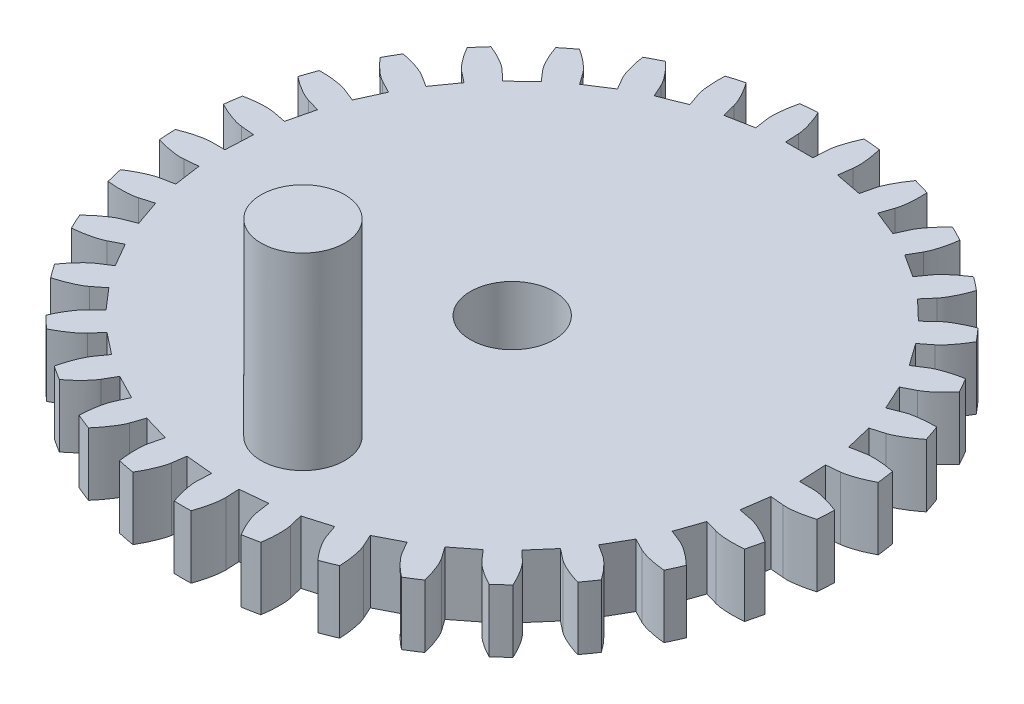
SolidWorks part; units mm, degrees
ref_plane "Front Plane" through (0, 0, 0) normal (0, 0, 1) x (1, 0, 0)
ref_plane "Top Plane" through (0, 0, 0) normal (0, 1, 0) x (1, 0, 0)
ref_plane "Right Plane" through (0, 0, 0) normal (1, 0, 0) x (0, 0, -1)
sketch "Sketch1" plane through (0, 0, 0) normal (0, 1, 0) x (1, 0, 0)
  line L0 (0, 0) -> (0, 7.1885) construction
  line L1 (0, 0) -> (-7.1885, 0) construction
  line L2 (0, 0) -> (-7.8661, -0.3747) construction
  line L3 (0, 0) -> (-7.1559, -0.6833) construction
  line L4 (0, 0) -> (-7.0586, -1.3604) construction
  circle A0 centre (0, 0) radius 7.425 construction
  circle A1 centre (0, 0) radius 7.1885 construction
  circle A2 centre (0, 0) radius 6.8625 construction
  circle A3 centre (0, 0) radius 7.875 construction
  spline S0 degree 4 poles (-7.1885, 0) (-7.2031, 0) (-7.2439, -0.0015) (-7.3209, -0.0102) (-7.4452, -0.0329) (-7.6013, -0.0738) (-7.7992, -0.1404) (-8.0266, -0.236) (-8.2692, -0.3588) (-8.5239, -0.5106) (-8.769, -0.6779) (-9.0044, -0.8587) (-9.23, -1.0515) (-9.4921, -1.2984) (-9.7903, -1.6142) (-10.1134, -2.0073) (-10.4484, -2.4843) (-10.7537, -2.9936) (-11.0239, -3.5221) (-11.2598, -4.067) (-11.4623, -4.6247) (-11.611, -5.1229) (-11.7186, -5.5539) (-11.7954, -5.9181) (-11.849, -6.2072) (-11.8954, -6.5052) (-11.9338, -6.7907) (-11.9656, -7.1004) (-11.9888, -7.3705) (-12.0103, -7.7701) (-12.0165, -8.01) (-12.0198, -8.3936) (-12.0125, -8.5784) (-12.0095, -8.7377) (-12.0064, -8.7807) (-12.0052, -8.816) knots 0 0 0 0 0 0.005377 0.015084 0.028532 0.04661 0.064855 0.092111 0.119476 0.146842 0.174209 0.201575 0.228941 0.256307 0.307035 0.361767 0.4165 0.471232 0.525964 0.580697 0.635429 0.690161 0.717528 0.744894 0.77226 0.799626 0.826992 0.854358 0.881725 0.909091 0.954545 0.977273 0.988636 1 1 1 1 1 construction
  spline S1 degree 4 poles (-7.1885, 0) (-7.2031, 0) (-7.2439, -0.0015) (-7.3209, -0.0102) (-7.4452, -0.0329) (-7.6013, -0.0738) (-7.7992, -0.1404) (-8.0266, -0.236) (-8.2692, -0.3588) (-8.5239, -0.5106) (-8.769, -0.6779) (-9.0044, -0.8587) (-9.23, -1.0515) (-9.4921, -1.2984) (-9.7903, -1.6142) (-10.1134, -2.0073) (-10.4484, -2.4843) (-10.7537, -2.9936) (-11.0239, -3.5221) (-11.2598, -4.067) (-11.4623, -4.6247) (-11.611, -5.1229) (-11.7186, -5.5539) (-11.7954, -5.9181) (-11.849, -6.2072) (-11.8954, -6.5052) (-11.9338, -6.7907) (-11.9656, -7.1004) (-11.9888, -7.3705) (-12.0026, -7.6277) (-12.0083, -7.7639) (-12.0106, -7.8313) knots 0 0 0 0 0 0.005377 0.015084 0.028532 0.04661 0.064855 0.092111 0.119476 0.146842 0.174209 0.201575 0.228941 0.256307 0.307035 0.361767 0.4165 0.471232 0.525964 0.580697 0.635429 0.690161 0.717528 0.744894 0.77226 0.799626 0.826992 0.854358 0.881725 0.909091 0.909091 0.909091 0.909091 0.909091
  dimension "D1" = 15.75
  dimension "D2" = 14.85
  dimension "D3" = 14.377
  dimension "D4" = 13.725
  dimension "D5" = 7.1885
  dimension "D6" = 2.727
  dimension "D7" = 5.455
  dimension "D8" = 10.909
sketch "Sketch2" plane through (0, 0, 0) normal (0, 1, 0) x (1, 0, 0)
  line L0 (0, 0) -> (-7.8661, -0.3747) construction
  line L1 (0, 0) -> (-7.8661, -0.3747) construction
  line L2 (0, 0) -> (-7.1559, -0.6833) construction
  line L3 (0, 0) -> (-7.1885, 0) construction
  line L4 (0, 0) -> (-7.0586, -1.3604) construction
  line L5 (0, 0) -> (-7.1559, -0.6833) construction
  line L6 (0, 0) -> (-7.1885, 0) construction
  line L7 (0, 0) -> (-7.0586, -1.3604) construction
  line L8 (-7.1559, -0.6833) -> (-6.8314, -0.6523)
  line L9 (-6.8314, -0.6523) -> (-6.7385, -1.2987)
  line L10 (-6.7385, -1.2987) -> (-7.0586, -1.3604) construction
  line L11 (-6.7385, -1.2987) -> (-0.9819, -0.1893)
  line L12 (-7.1885, 0) -> (-1, 0)
  circle A0 centre (0, 0) radius 6.8625 construction
  circle A1 centre (0, 0) radius 7.1885 construction
  circle A2 centre (0, 0) radius 7.425 construction
  circle A3 centre (0, 0) radius 7.875 construction
  circle A4 centre (0, 0) radius 6.8625 construction
  circle A5 centre (0, 0) radius 7.1885 construction
  circle A6 centre (0, 0) radius 7.425 construction
  circle A7 centre (0, 0) radius 7.875 construction
  arc A8 (-7.8539, -0.5759) -> (-7.8731, -0.1733) centre (0, 0) cw
  circle A11 centre (0, 0) radius 1 construction
  arc A12 (-1, 0) -> (-0.9819, -0.1893) centre (0, 0) ccw
  spline S0 degree 4 poles (-36.5437, -999.5138) (-4.8519, -22.2083) (-5.3534, -0.4813) (-6.4403, 0.1499) (-7.4452, -0.0329) (-7.6013, -0.0738) (-7.7992, -0.1404) (-8.0266, -0.236) (-8.2692, -0.3588) (-8.5239, -0.5106) (-8.769, -0.6779) (-9.0044, -0.8587) (-9.23, -1.0515) (-9.4921, -1.2984) (-9.7903, -1.6142) (-10.1134, -2.0073) (-10.4484, -2.4843) (-10.7537, -2.9936) (-11.0239, -3.5221) (-11.2598, -4.067) (-11.4623, -4.6247) (-11.611, -5.1229) (-11.7186, -5.5539) (-11.7954, -5.9181) (-11.849, -6.2072) (-11.8954, -6.5052) (-11.9338, -6.7907) (-11.9656, -7.1004) (-12.0782, -8.4106) (-12.0508, -11.7087) (-10.6223, 22.6039) (-44.4811, -1007.2404) knots -0.330102 -0.330102 -0.330102 -0.330102 -0.330102 0.005377 0.015084 0.028532 0.04661 0.064855 0.092111 0.119476 0.146842 0.174209 0.201575 0.228941 0.256307 0.307035 0.361767 0.4165 0.471232 0.525964 0.580697 0.635429 0.690161 0.717528 0.744894 0.77226 0.799626 0.826992 0.854358 0.881725 1.330552 1.330552 1.330552 1.330552 1.330552 only from (-7.1885, 0) to (-12.0106, -7.8313) construction
  spline S1 degree 4 poles (-7.1885, 0) (-7.2031, 0) (-7.2439, -0.0015) (-7.3209, -0.0102) (-7.4452, -0.0329) (-7.6013, -0.0738) (-7.7308, -0.1173) (-7.8242, -0.1533) (-7.8715, -0.1726) (-7.8731, -0.1733) knots 0 0 0 0 0 0.005377 0.015084 0.028532 0.04661 0.064855 0.065473 0.065473 0.065473 0.065473 0.065473
  spline S2 degree 4 poles (-7.1559, -0.6833) (-7.1705, -0.6847) (-7.2113, -0.6871) (-7.2887, -0.6857) (-7.4146, -0.675) (-7.5739, -0.6491) (-7.7069, -0.618) (-7.8034, -0.5911) (-7.8523, -0.5764) (-7.8539, -0.5759) knots 0 0 0 0 0 0.005377 0.015084 0.028532 0.04661 0.064855 0.065473 0.065473 0.065473 0.065473 0.065473
  point P21 (-6.8314, -0.6523)
  point P24 (-6.7385, -1.2987)
  dimension "D2" = 2
extrude "Boss-Extrude1" add sketch "Sketch2" along normal blind 1.5
pattern_circular "CirPattern1" count 33 over 360 of "Boss-Extrude1"
sketch "Sketch3" plane through (0, 1.5, 0) normal (0, 1, 0) x (1, 0, 0)
  line L1 (0.5, 0) -> (-0.5, 0)
  line L2 (0.5, 0) -> (0.5, 2)
  line L3 (0.5, 2) -> (-0.5, 2)
  line L4 (-0.5, 0) -> (-0.5, 2)
  line L5 (0.5, 0) -> (-0.5, 2) construction
  line L6 (0.5, 2) -> (-0.5, 0) construction
  circle A0 centre (0, 0) radius 1 construction
  point P0 (0, 1)
  dimension "D1" = 2
  dimension "D2" = 1
extrude "Cut-Extrude1" [suppressed] cut sketch "Sketch3" against normal up to surface (1.5 mm away)
sketch "Sketch4" plane through (0, 1.5, 0) normal (0, 1, 0) x (1, 0, 0)
  line L0 (0, -5) -> (0, 0) construction
  circle A0 centre (0, -5) radius 1
  dimension "D1" = 2
  dimension "D2" = 5
extrude "Boss-Extrude2" add sketch "Sketch4" along normal blind 4.5
equation "\"Module\"= .45"
equation "\"Number of Teeth\"= 33"
equation "\"Pressure Angle\"= 14.5deg"
equation "\"Pitch Diameter\"= \"Number of Teeth\" * \"Module\""
equation "\"Circular Pitch\"= pi * \"Module\""
equation "\"Addendum\"= \"Module\""
equation "\"Dedendum\"= 1.25 * \"Module\""
equation "\"Base Diameter\"= \"Pitch Diameter\" * cos ( \"Pressure Angle\" )"
equation "\"Base Radius\"= \"Base Diameter\" / 2"
equation "\"Width\"= 1.5"
equation "\"Outside Diameter\"= \"Pitch Diameter\" + 2 * \"Addendum\""
equation "\"D1@Sketch1\"=\"Outside Diameter\""
equation "\"D3@Sketch1\"=\"Base Diameter\""
equation "\"Root Diameter\"= \"Pitch Diameter\" - 2 * \"Dedendum\""
equation "\"D4@Sketch1\"=\"Root Diameter\""
equation "\"Tooth Angle\"= 360 / \"Number of Teeth\""
equation "\"D6@Sketch1\"=\"Tooth Angle\"/4"
equation "\"D7@Sketch1\"=\"Tooth Angle\"/2"
equation "\"D8@Sketch1\"=\"Tooth Angle\""
equation "\"D2@Sketch1\" = \"Pitch Diameter\""
equation "\"Shaft Diameter\"= 2"
equation "\"D1@CirPattern1\" = \"Number of Teeth\""
equation "\"D2@Sketch2\"= \"Shaft Diameter\""
equation "\"D1@Boss-Extrude1\" = \"Width\""
